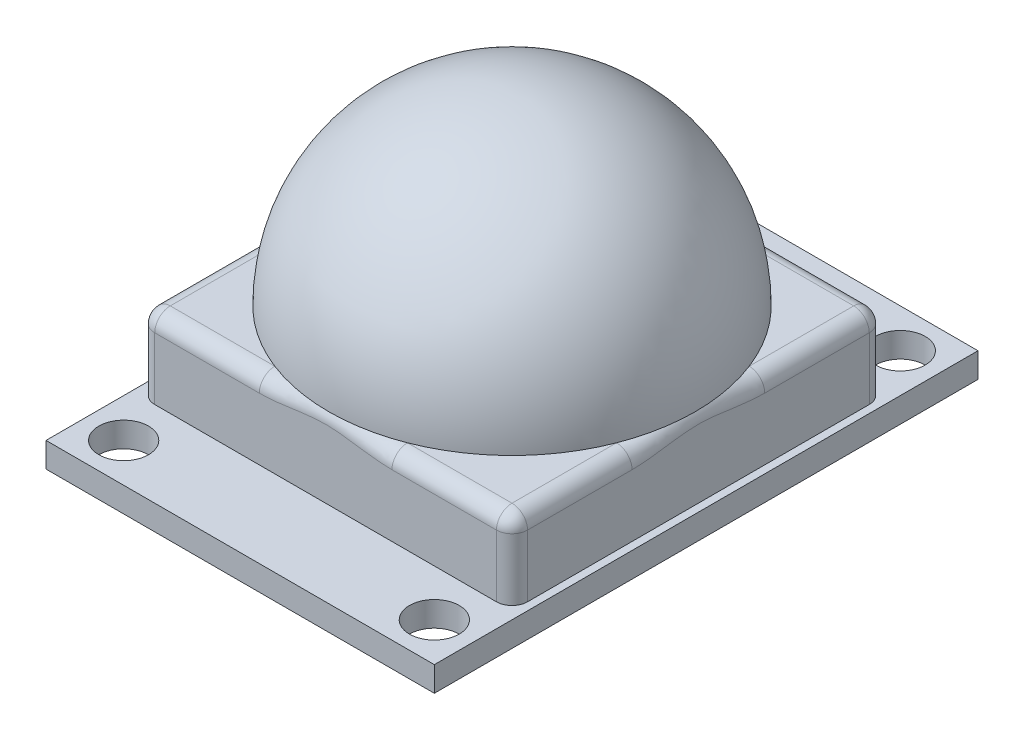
SolidWorks part; units mm, degrees
ref_plane "Plan de face" through (0, 0, 0) normal (0, 0, 1) x (1, 0, 0)
ref_plane "Plan de dessus" through (0, 0, 0) normal (0, 1, 0) x (1, 0, 0)
ref_plane "Plan de droite" through (0, 0, 0) normal (1, 0, 0) x (0, 0, -1)
sketch "Esquisse2" plane through (0, 0, 0) normal (0, 1, 0) x (1, 0, 0)
  line L0 (2.5, 32.5) -> (25.7757, 32.5) construction
  line L1 (0, 0) -> (25, 0)
  line L2 (0, 0) -> (0, 35)
  line L3 (0, 35) -> (25, 35)
  line L4 (25, 0) -> (25, 35)
  line L5 (2.5, 32.5) -> (2.5, -4.6978) construction
  line L6 (2.5, 2.5) -> (36.1704, 2.5) construction
  line L8 (12.5, 0) -> (12.5, 35) construction
  line L9 (22.5, 26.9006) -> (22.5, 6.1942) construction
  line L10 (2.5, 26.9006) -> (2.5, 6.8181) construction
  line L11 (22.5, 7.5) -> (2.5, 7.5) construction
  line L12 (0, 17.5) -> (25, 17.5) construction
  circle A0 centre (22.5, 32.5) radius 1.6
  circle A1 centre (22.5, 27.5) radius 0.5994
  circle A9 centre (2.5, 27.5) radius 0.5994
  circle A10 centre (2.5, 7.5) radius 0.5994
  circle A12 centre (22.5, 7.5) radius 0.5994
  circle A26 centre (2.5, 32.5) radius 1.6
  circle A28 centre (2.5, 2.5) radius 1.6
  circle A30 centre (22.5, 2.5) radius 1.6
  dimension "D3" = 2.5
  dimension "D5" = 2.5
  dimension "D4" = 1.1989
  dimension "D8" = 3.2
  dimension "D6" = 2.5
  dimension "D1" = 35
  dimension "D2" = 2.5
  dimension "D7" = 25
  dimension "D9" = 20
  dimension "D10" = 25
  dimension "D11" = 2.5
extrude "Extrusion1" add sketch "Esquisse2" along normal blind 1.6
sketch "Esquisse3" plane through (0, 1.6, 0) normal (0, 1, 0) x (-1, 0, 0)
  line L0 (-12.5, -35) -> (-12.5, 0) construction
  line L1 (-0.5, -29.5) -> (-24.5, -29.5)
  line L2 (-0.5, -29.5) -> (-0.5, -5.5)
  line L3 (-0.5, -5.5) -> (-24.5, -5.5)
  line L4 (-24.5, -29.5) -> (-24.5, -5.5)
  line L5 (-25, -35) -> (0, -35) construction
  line L6 (0, 0) -> (-25, 0) construction
  line L7 (0, -17.5) -> (-25, -17.5) construction
  line L8 (0, -35) -> (0, 0) construction
  line L9 (-25, 0) -> (-25, -35) construction
  dimension "D1" = 24
  dimension "D2" = 24
extrude "Extrusion2" add sketch "Esquisse3" along normal blind 5
sketch "Esquisse4" plane through (0, 6.6, 0) normal (0, 1, 0) x (-1, 0, 0)
  line L0 (-12.5, -29.3) -> (-12.5, -5.7) construction
  line L3 (-12.5, -29.3) -> (-12.5, -5.7)
  arc A0 (-12.5, -29.3) -> (-12.5, -5.7) centre (-12.5, -17.5) cw
  dimension "D1" = 11.8
revolve "Révolution1" add sketch "Esquisse4" angle 180 about L0
fillet "Congé1" radius 1 8 edges at (0.5, 4.1, -29.5) (0.5, 4.1, -5.5) (24.5, 4.1, -5.5) (24.5, 4.1, -29.5) (0.5, 6.6, -17.5) (12.5, 6.6, -5.5) (24.5, 6.6, -17.5) (12.5, 6.6, -29.5)
